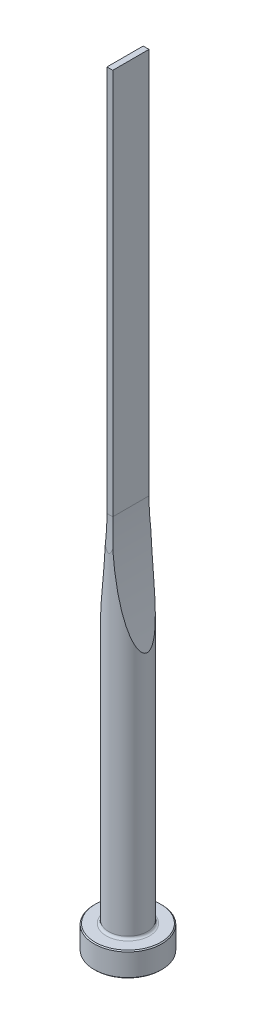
SolidWorks part; units mm, degrees
ref_plane "Front Plane" through (0, 0, 0) normal (0, 0, 1) x (1, 0, 0)
ref_plane "Top Plane" through (0, 0, 0) normal (0, 1, 0) x (1, 0, 0)
ref_plane "Right Plane" through (0, 0, 0) normal (1, 0, 0) x (0, 0, -1)
sketch "Sketch1" plane through (0, 0, 0) normal (0, 0, 1) x (1, 0, 0)
  line L0 (0, 0) -> (6.8, 0)
  line L1 (55, 0) -> (-55, 0) construction
  line L2 (7, 0.2) -> (7, 4.8)
  line L3 (6.8, 5) -> (4.5, 5)
  line L4 (4, 5.5) -> (4, 160)
  line L5 (0, 160) -> (4, 160)
  line L6 (7, 4.8) -> (6.8, 5)
  line L7 (6.8, 0) -> (7, 0.2)
  line L8 (0, 160) -> (0, 0)
  arc A0 (4, 5.5) -> (4.5, 5) centre (4.5, 5.5) ccw
  point P1 (7, 0)
  point P6 (7, 5)
  dimension "D4" = 0.5
  dimension "D1" = 4
  dimension "D2" = 7
  dimension "D3" = 5
  dimension "D5" = 160
revolve "Revolve1" add sketch "Sketch1" angle 360 about L8
sketch "Sketch2" plane through (0, 0, 0) normal (0, 0, 1) x (1, 0, 0)
  line L0 (0.6, 160) -> (0.6, 80)
  line L1 (4, 160) -> (-4, 160) construction
  line L2 (-0.6, 160) -> (-0.6, 80)
  line L3 (4, 160) -> (4, 55.4961)
  line L4 (-4, 160) -> (-4, 55.4961)
  line L5 (0, -7.7) -> (0, 7.7) construction
  line L6 (4, 160) -> (0.6, 160)
  line L8 (-0.6, 160) -> (-4, 160)
  arc A0 (0.6, 80) -> (4, 55.4961) centre (90.6, 80) ccw
  arc A1 (-0.6, 80) -> (-4, 55.4961) centre (-90.6, 80) cw
  dimension "D4" = 90
  dimension "D1" = 80
  dimension "D2" = 1.2
  dimension "D3" = 0.6
extrude "Cut-Extrude1" cut sketch "Sketch2" against normal mid plane 10
sketch "Sketch3" plane through (0, 0, 0) normal (1, 0, 0) x (0, 0, -1)
  line L0 (3.75, 160) -> (3.75, 80)
  line L1 (-3.9547, 160) -> (3.9547, 160) construction
  line L2 (-3.75, 160) -> (-3.75, 80)
  line L3 (4, 160) -> (4, 73.2965)
  line L4 (3.75, 160) -> (4, 160)
  line L5 (0, 7.7) -> (0, -7.7) construction
  line L6 (-4, 160) -> (-4, 73.2965)
  line L8 (-3.75, 160) -> (-4, 160)
  arc A0 (3.75, 80) -> (4, 73.2965) centre (93.75, 80) ccw
  arc A1 (-3.75, 80) -> (-4, 73.2965) centre (-93.75, 80) cw
  dimension "D2" = 90
  dimension "D1" = 80
  dimension "D3" = 7.5
  dimension "D4" = 3.75
extrude "Cut-Extrude2" cut sketch "Sketch3" against normal mid plane 10
